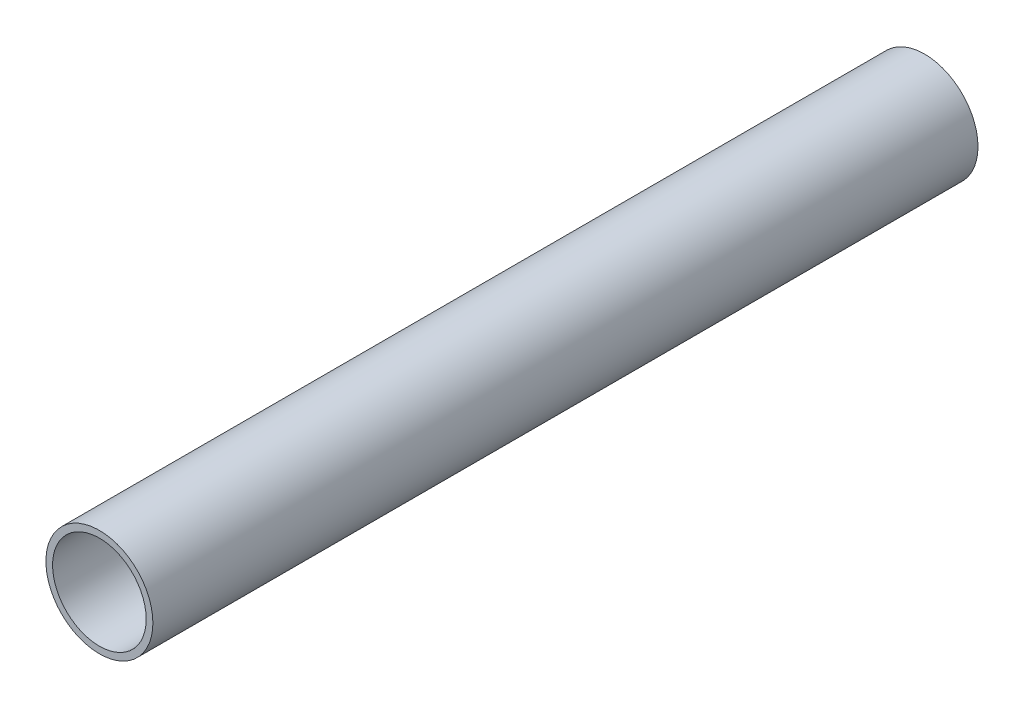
SolidWorks part; units mm, degrees
ref_plane "Plan de face" through (0, 0, 0) normal (0, 0, 1) x (1, 0, 0)
ref_plane "Plan de dessus" through (0, 0, 0) normal (0, 1, 0) x (1, 0, 0)
ref_plane "Plan de droite" through (0, 0, 0) normal (1, 0, 0) x (0, 0, -1)
sketch "Esquisse1" plane through (0, 0, 0) normal (0, 0, 1) x (1, 0, 0)
  circle A0 centre (0, 0) radius 16
  dimension "D1" = 32
extrude "Extru.-Mince1" add sketch "Esquisse1" along normal mid plane 246.8 thin
